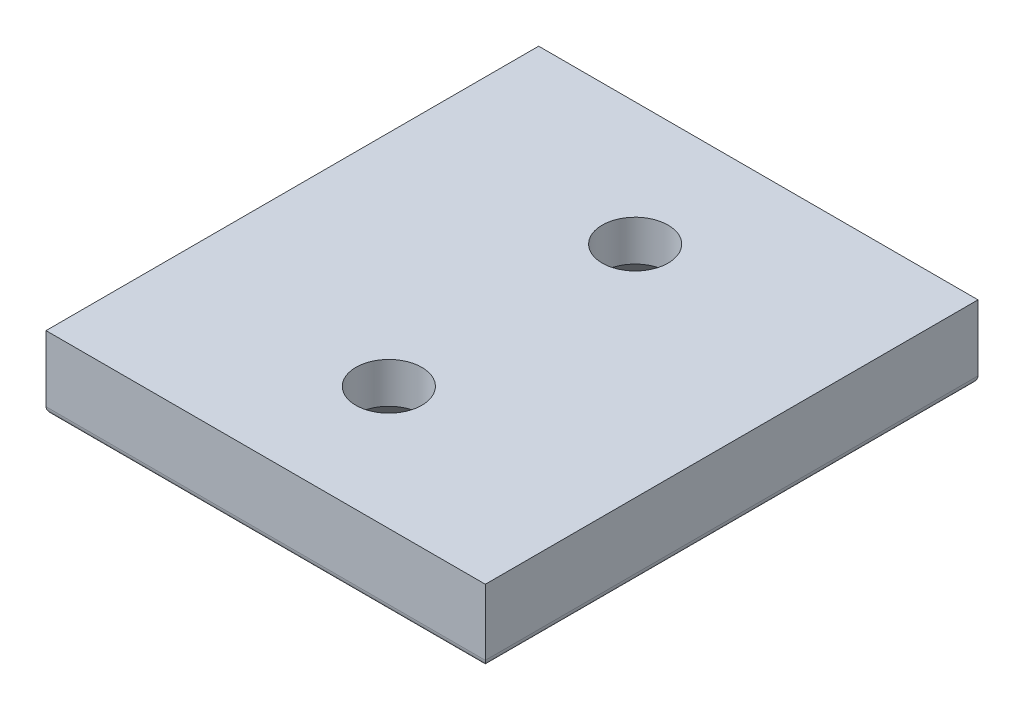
SolidWorks part; units mm, degrees
ref_plane "Front Plane" through (0, 0, 0) normal (0, 0, 1) x (1, 0, 0)
ref_plane "Top Plane" through (0, 0, 0) normal (0, 1, 0) x (1, 0, 0)
ref_plane "Right Plane" through (0, 0, 0) normal (1, 0, 0) x (0, 0, -1)
sketch "Sketch1" plane through (0, 0, 0) normal (0, 1, 0) x (1, 0, 0)
  line L1 (-30, -33.64) -> (30, -33.64)
  line L2 (-30, -33.64) -> (-30, 33.64)
  line L3 (-30, 33.64) -> (30, 33.64)
  line L4 (30, -33.64) -> (30, 33.64)
  line L5 (-30, -33.64) -> (30, 33.64) construction
  line L6 (-30, 33.64) -> (30, -33.64) construction
  point P0 (0, 0)
  dimension "D1" = 60
  dimension "D2" = 67.28
extrude "Boss-Extrude1" add sketch "Sketch1" along normal blind 10
fillet "Fillet1" radius 1 4 edges at (0, 0, -33.64) (-30, 0, 0) (0, 0, 33.64) (30, 0, 0)
sketch "Sketch2" plane through (0, 0, 0) normal (0, -1, 0) x (1, 0, 0)
  line L0 (30, -33.64) -> (-30, -33.64) construction
  line L1 (-30, -33.64) -> (-30, 33.64) construction
  line L2 (-30, 33.64) -> (30, 33.64) construction
  line L3 (30, 33.64) -> (30, -33.64) construction
  circle A0 centre (-20, 23.64) radius 4
  circle A1 centre (-20, -23.64) radius 4
  circle A2 centre (20, -23.64) radius 4
  circle A3 centre (20, 23.64) radius 4
  dimension "D2" = 8
  dimension "D3" = 10
  dimension "D4" = 10
  dimension "D5" = 10
  dimension "D6" = 10
  dimension "D7" = 10
  dimension "D8" = 10
sketch "Sketch3" plane through (0, 0, 0) normal (0, -1, 0) x (-1, 0, 0)
  line L0 (0, 0) -> (0, -33.64)
  line L1 (30, -33.64) -> (-30, -33.64) construction
  line L2 (0, 0) -> (0, 33.64)
  line L3 (-30, 33.64) -> (30, 33.64) construction
hole_wizard "CSK for M8 Hex Socket Countersunk Cap Screw3" positions "Sketch6" profile "Sketch5" countersink size "M8" standard "ISO"
sketch "Sketch6" plane through (0, 0, 0) normal (0, -1, 0) x (-1, 0, 0)
  line L1 (-30, 33.64) -> (30, 33.64) construction
  line L2 (0, 0) -> (0, 33.64)
  line L4 (0, 0) -> (0, -33.64)
  line L5 (30, -33.64) -> (-30, -33.64) construction
  point P0 (0, 16.82)
  point P3 (0, -16.82)
  point P33 (0, -16.82)
sketch "Sketch5" plane through (0, 0, -16.82) normal (1, 0, 0) x (0, 0, -1)
  line L0 (0, 0) -> (0, 10)
  line L1 (0, 10) -> (4.5, 10)
  line L2 (4.5, 10) -> (4.5, 4.46)
  line L3 (4.5, 4.46) -> (8.96, 0)
  line L5 (8.96, 0) -> (0, 0)
  line L6 (-4.5, 4.46) -> (-8.96, 0) construction
  line L11 (0, -6.35) -> (0, 107.95) construction
  dimension "Thru Hole Dia." = 9
  dimension "Thru Hole Depth" = 10
  dimension "Near C'Sink Dia." = 17.92
  dimension "Near C'Sink Angle" = 90
